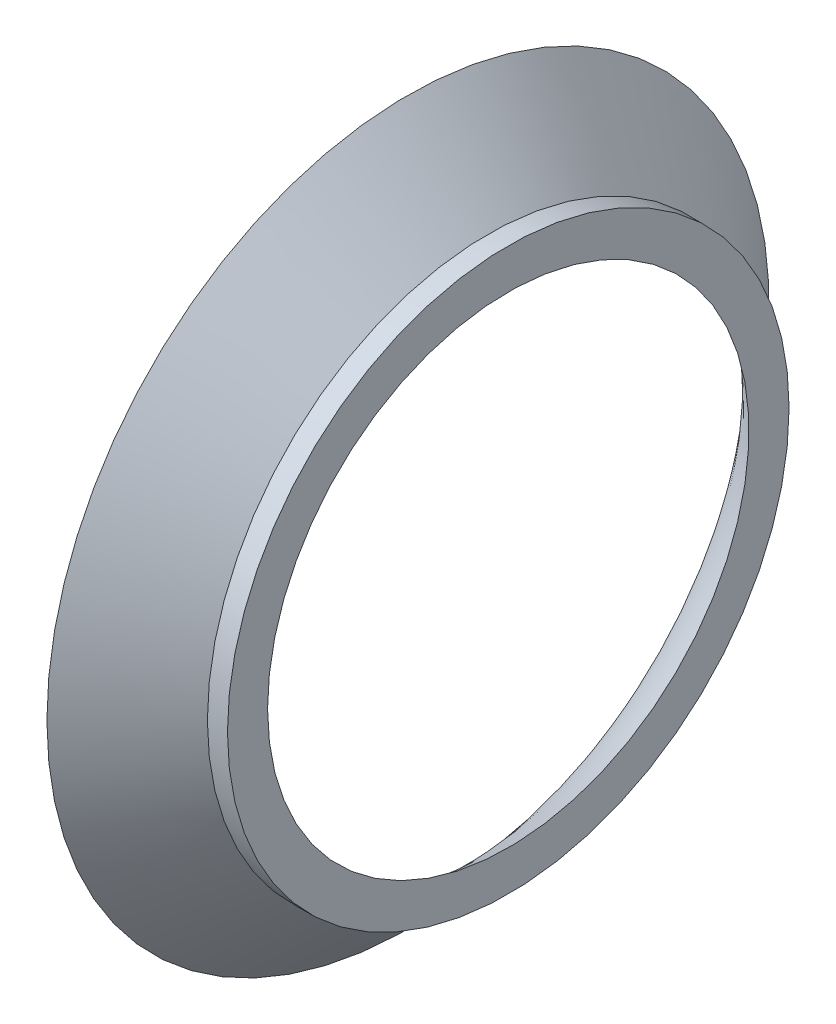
SolidWorks part; units mm, degrees
ref_plane "Plan de face" through (0, 0, 0) normal (0, 0, 1) x (1, 0, 0)
ref_plane "Plan de dessus" through (0, 0, 0) normal (0, 1, 0) x (1, 0, 0)
ref_plane "Plan de droite" through (0, 0, 0) normal (1, 0, 0) x (0, 0, -1)
sketch "Esquisse1" plane through (0, 0, 0) normal (0, 0, 1) x (1, 0, 0)
  line L0 (0, 0) -> (13.6425, 0) construction
  line L1 (-1, 14) -> (-5, 18) construction
  line L2 (-1, 14) -> (-5, 18)
  line L3 (0, 14) -> (-1, 14) construction
  line L4 (0, 14) -> (-1, 14)
  line L5 (0, -15) -> (0, 15) construction
  line L6 (0, 12) -> (0, 14)
  line L7 (11.4204, 12) -> (0, 12) construction
  arc A0 (0, 12) -> (-5, 18) centre (8.626, 24.2716) cw
  dimension "D1" = 15
revolve "Révolution1" add sketch "Esquisse1" angle 360 about L0
